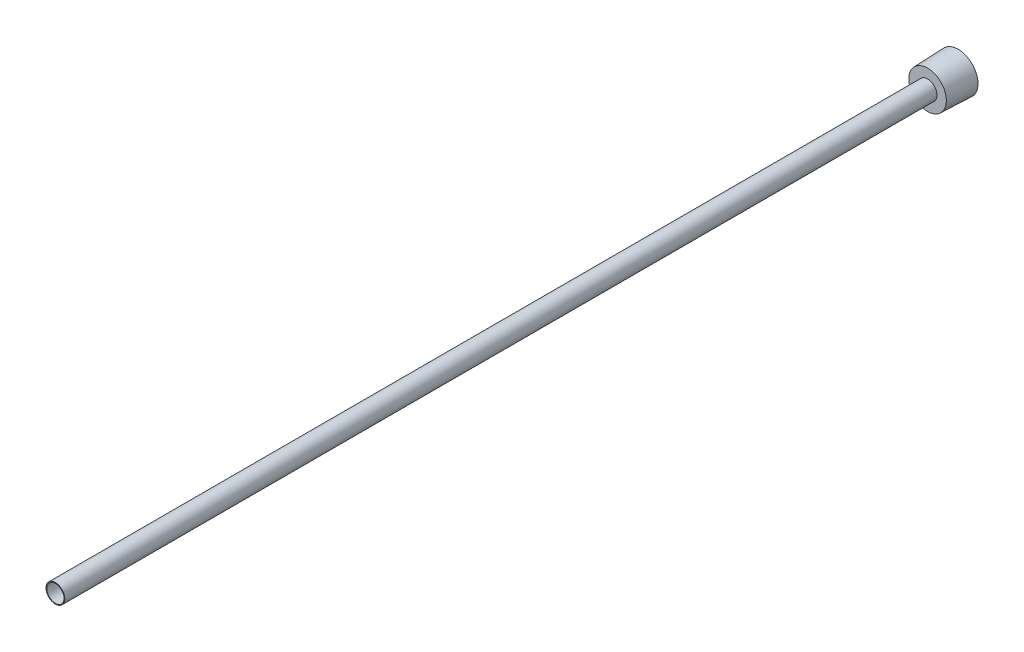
SolidWorks part; units mm, degrees
ref_plane "Front Plane" through (0, 0, 0) normal (0, 0, 1) x (1, 0, 0)
ref_plane "Top Plane" through (0, 0, 0) normal (0, 1, 0) x (1, 0, 0)
ref_plane "Right Plane" through (0, 0, 0) normal (1, 0, 0) x (0, 0, -1)
sketch "Sketch1" plane through (0, 0, 0) normal (1, 0, 0) x (0, 0, -1)
  line L0 (-331.1242, 0) -> (49668.8758, 0) construction
  line L1 (0, 0) -> (-304.8, 0)
  line L6 (0, 0) -> (0, 6.7183)
  line L7 (0, 6.7183) -> (-10.3124, 6.3421)
  line L8 (-10.3124, 3.175) -> (-304.8, 3.175)
  line L9 (-10.3124, 6.3421) -> (-10.3124, 3.175)
  line L10 (-304.8, 3.175) -> (-304.8, 0)
  dimension "D1" = 6.35
  dimension "D2" = 10.3124
  dimension "D3" = 2.089
  dimension "D4" = 13.4366
  dimension "D5" = 304.8
revolve "Revolve1" add sketch "Sketch1" angle 360 about L0
sketch "Sketch2" plane through (0, 0, 304.8) normal (0, 0, 1) x (1, 0, 0)
  circle A0 centre (0, 0) radius 2.921
  dimension "D1" = 5.842
extrude "Cut-Extrude1" cut sketch "Sketch2" against normal through all
sketch "Sketch3" plane through (0, 0, 0) normal (0, 0, -1) x (-1, 0, 0)
  line L0 (0, 7.3901) -> (0, -7.3901) construction
  line L1 (-3.175, -1.8331) -> (0, -3.6662)
  line L2 (0, -3.6662) -> (3.175, -1.8331)
  line L3 (3.175, -1.8331) -> (3.175, 1.8331)
  line L4 (3.175, 1.8331) -> (0, 3.6662)
  line L5 (0, 3.6662) -> (-3.175, 1.8331)
  line L6 (-3.175, 1.8331) -> (-3.175, -1.8331)
  circle A0 centre (0, 0) radius 3.175 construction
  dimension "D1" = 6.35
extrude "Cut-Extrude2" cut sketch "Sketch3" against normal blind 6.35
